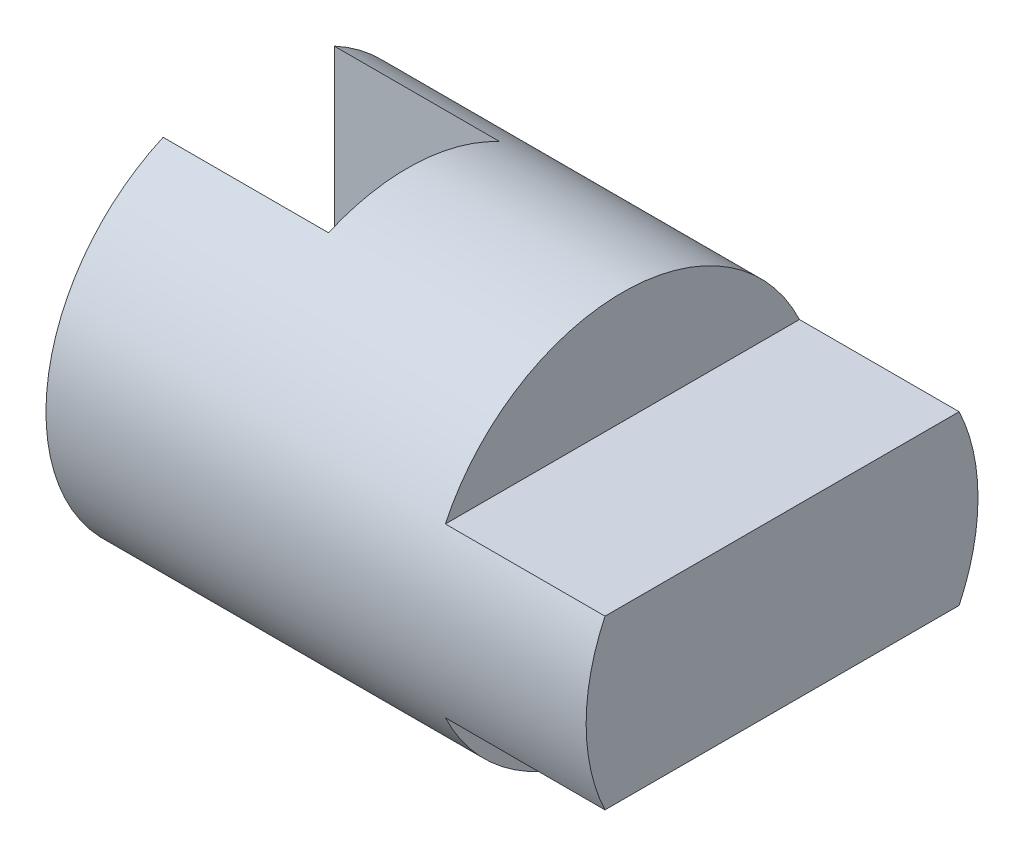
SolidWorks part; units mm, degrees
ref_plane "前视基准面" through (0, 0, 0) normal (0, 0, 1) x (1, 0, 0)
ref_plane "上视基准面" through (0, 0, 0) normal (0, 1, 0) x (1, 0, 0)
ref_plane "右视基准面" through (0, 0, 0) normal (1, 0, 0) x (0, 0, -1)
sketch "草图1" plane through (0, 0, 0) normal (0, 0, 1) x (1, 0, 0)
  line L0 (-80.4402, 0) -> (78.7378, 0) construction
  line L1 (-55.4944, 0) -> (-55.4944, 37.2702)
  line L2 (-55.4944, 37.2702) -> (47.2586, 37.2702)
  line L3 (47.2586, 37.2702) -> (47.2586, 0)
  line L4 (47.2586, 0) -> (-55.4944, 0)
revolve "旋转1" add sketch "草图1" angle 360 about L0
sketch "草图2" plane through (0, 0, 0) normal (0, 0, 1) x (1, 0, 0)
  line L0 (16.8864, 37.2702) -> (16.8864, 15.9589)
  line L1 (47.2586, 37.2702) -> (-55.4944, 37.2702) construction
  line L2 (16.8864, 15.9589) -> (47.2586, 15.9589)
  line L3 (47.2586, -37.2702) -> (47.2586, 37.2702) construction
  line L4 (47.2586, 15.9589) -> (47.2586, 37.2702)
  line L5 (47.2586, 37.2702) -> (16.8864, 37.2702)
  line L6 (16.8864, -15.9589) -> (47.2586, -15.9589)
  line L7 (47.2586, -15.9589) -> (47.2586, -37.2702)
  line L8 (47.2586, -37.2702) -> (16.8864, -37.2702)
  line L9 (-55.4944, -37.2702) -> (47.2586, -37.2702) construction
  line L10 (16.8864, -37.2702) -> (16.8864, -15.9589)
extrude "切除-拉伸1" cut sketch "草图2" against normal through all and the other way through all
sketch "草图3" plane through (0, 0, 0) normal (0, 1, 0) x (1, 0, 0)
  line L0 (-55.4944, 17.5792) -> (-24.0323, 17.5792)
  line L1 (-55.4944, 37.2702) -> (-55.4944, -37.2702) construction
  line L2 (-24.0323, 17.5792) -> (-24.0323, -14.9845)
  line L3 (-24.0323, -14.9845) -> (-55.4944, -14.9845)
  line L4 (-55.4944, -14.9845) -> (-55.4944, 17.5792)
extrude "切除-拉伸2" cut sketch "草图3" against normal through all and the other way through all
